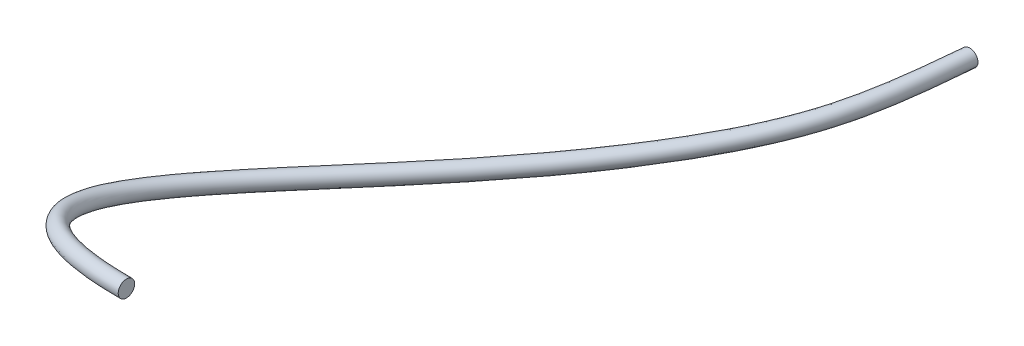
SolidWorks part; units mm, degrees
ref_plane "Płaszczyzna przednia" through (0, 0, 0) normal (0, 0, 1) x (1, 0, 0)
ref_plane "Płaszczyzna górna" through (0, 0, 0) normal (0, 1, 0) x (1, 0, 0)
ref_plane "Płaszczyzna prawa" through (0, 0, 0) normal (1, 0, 0) x (0, 0, -1)
sketch3d "Szkic 3D1"
  line L0 (0, 0, 400) -> (-125.3097, 80.4761, 333.2335) construction
  line L1 (-125.3097, 80.4761, 333.2335) -> (-416, 35, 599) construction
  line L14 (0, 0, 0) -> (0, 0, 400) construction
  line L26 (-416, 35, 599) -> (-166, 35, 599) construction
  circle A6 centre (-166, 35, 599) radius 5 construction
  spline_without_curve S0
  point P5 (-161, 35, 599)
  dimension "D1" = 250
  dimension "D3" = 750
  dimension "D2" = 400
sketch "Szkic2" plane through (0, 0, 0) normal (0, 0, 1) x (1, 0, 0)
  circle A0 centre (0, 0) radius 7.5
  dimension "D1" = 15
sweep "Wyciągnięcie po ścieżce1" add profiles "Szkic2" path "Szkic 3D1"
